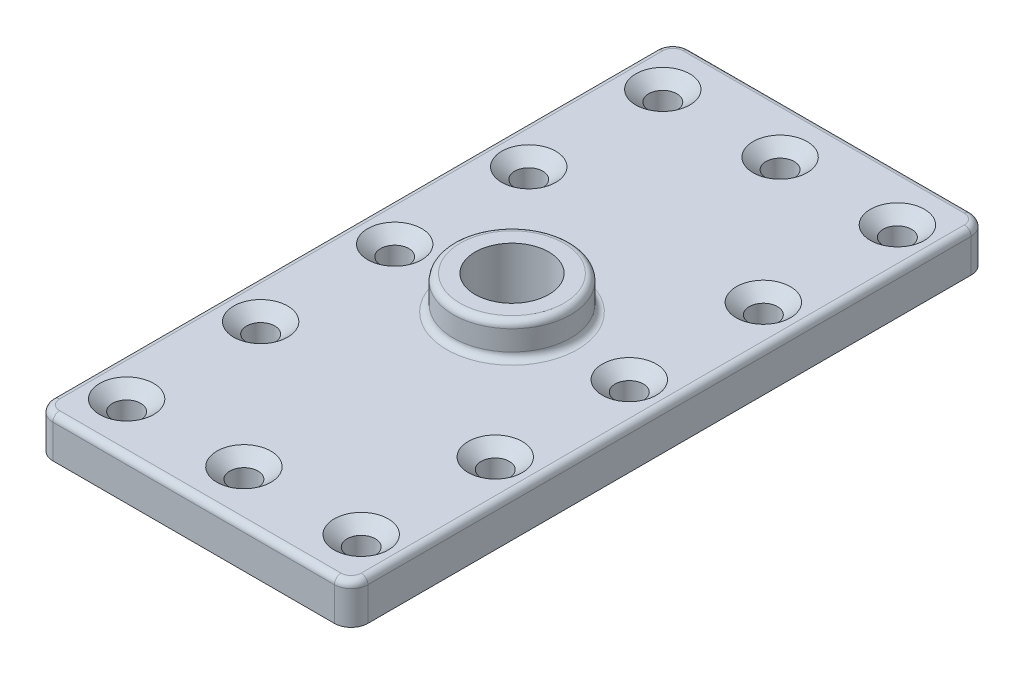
SolidWorks part; units mm, degrees
ref_plane "Front" through (0, 0, 0) normal (0, 0, 1) x (1, 0, 0)
ref_plane "Top" through (0, 0, 0) normal (0, 1, 0) x (1, 0, 0)
ref_plane "Right" through (0, 0, 0) normal (1, 0, 0) x (0, 0, -1)
sketch "Sketch1" plane through (0, 0, 0) normal (0, 1, 0) x (1, 0, 0)
  line L0 (-47, 95) -> (47, -95) construction
  line L1 (-47, -95) -> (47, -95)
  line L2 (-47, -95) -> (-47, 95)
  line L3 (-47, 95) -> (47, 95)
  line L4 (47, -95) -> (47, 95)
  dimension "D1" = 190
  dimension "D2" = 94
extrude "plate" add sketch "Sketch1" along normal blind 12
sketch "Sketch2" plane through (0, 12, 0) normal (0, 1, 0) x (-1, 0, 0)
  circle A0 centre (0, 0) radius 17.5
  dimension "D1" = 35
extrude "boss" add sketch "Sketch2" along normal blind 10
sketch "Sketch3" plane through (0, 22, 0) normal (0, 1, 0) x (-1, 0, 0)
  circle A0 centre (0, 0) radius 11
  dimension "D1" = 22
extrude "center hole" cut sketch "Sketch3" against normal through all
hole_wizard "CSK for 5/16 Flat Head Machine Screw (100)1" positions "Sketch5" profile "Sketch4" countersink size "5/16" standard "Ansi Inch"
sketch "Sketch5" plane through (0, 12, 0) normal (0, 1, 0) x (-1, 0, 0)
  line L0 (47, 95) -> (-47, 95) construction
  line L1 (47, -95) -> (47, 95) construction
  point P0 (35, 80)
  dimension "D1" = 15
  dimension "D2" = 12
sketch "Sketch4" plane through (-35, 12, 80) normal (1, 0, 0) x (0, 0, 1)
  line L0 (0, 0) -> (0, 12)
  line L1 (0, 12) -> (4.2164, 12)
  line L2 (4.2164, 12) -> (4.2164, 3.2289)
  line L3 (4.2164, 3.2289) -> (8.0645, 0)
  line L5 (8.0645, 0) -> (0, 0)
  line L6 (-4.2164, 3.2289) -> (-8.0645, 0) construction
  line L11 (0, -6.35) -> (0, 107.95) construction
  dimension "Thru Hole Dia." = 8.4328
  dimension "Thru Hole Depth" = 12
  dimension "Near C'Sink Dia." = 16.129
  dimension "Near C'Sink Angle" = 100
fillet "R5" radius 5 4 edges at (-47, 6, -95) (47, 6, -95) (47, 6, 95) (-47, 6, 95)
fillet "R2" radius 2 10 edges at (0, 12, -17.5) (0, 22, 17.5) (47, 12, 0) (0, 12, 95) (-47, 12, 0) (0, 12, -95) (45.5355, 12, -93.5355) (-45.5355, 12, -93.5355) (-45.5355, 12, 93.5355) (45.5355, 12, 93.5355)
pattern_linear "LinearPattern" count 5 spacing 40 along (0, 0, -1) count 3 spacing 35 along (1, 0, 0) of "CSK for 5/16 Flat Head Machine Screw (100)1"
sketch "Sketch Pattern" plane through (0, 12, 0) normal (0, 1, 0) x (-1, 0, 0)
  line L0 (0, 0) -> (0, -49.2733) construction
  point P0 (35, 40)
  point P1 (35, 0)
  point P2 (35, -40)
  point P3 (35, -80)
  point P4 (0, -80)
  point P5 (-35, -80)
  point P6 (-35, -40)
  point P7 (-35, 0)
  point P8 (-35, 40)
  point P9 (-35, 80)
  point P10 (0, 80)
  dimension "D1" = 40
  dimension "D2" = 80
  dimension "D3" = 120
  dimension "D4" = 160
  dimension "D5" = 70
pattern_sketch "Sketch-Pattern1"
other "TableDrivenPattern" parameters "D0"=35, "D1"=0, "D2"=35, "D3"=40, "D4"=35, "D5"=80, "D6"=35, "D7"=40, "D8"=35, "D9"=80, "D10"=0, "D11"=80, "D12"=0, "D13"=80, "D14"=35, "D15"=0, "D16"=35, "D17"=40, "D18"=35, "D19"=80, "D20"=35, "D21"=40
